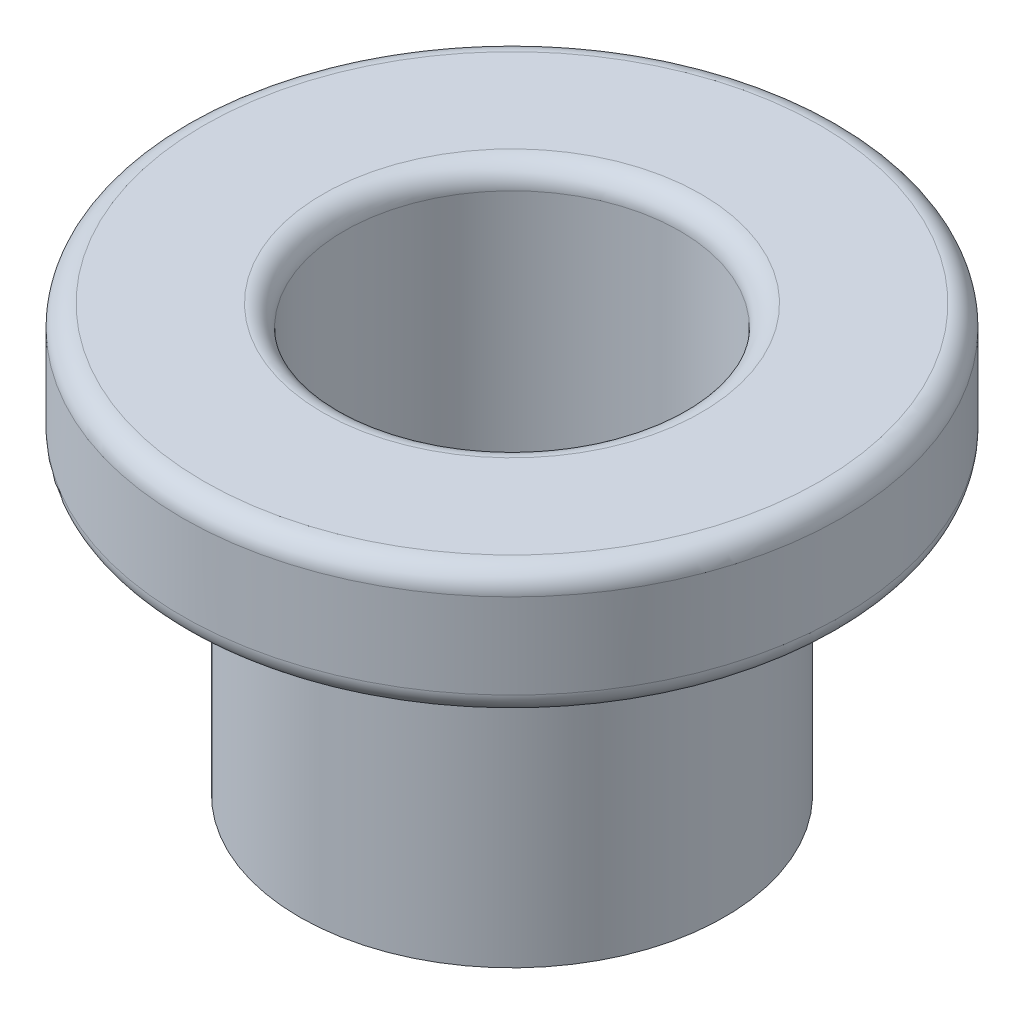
SolidWorks part; units mm, degrees
ref_plane "Front" through (0, 0, 0) normal (0, 0, 1) x (1, 0, 0)
ref_plane "Top" through (0, 0, 0) normal (0, 1, 0) x (1, 0, 0)
ref_plane "Right" through (0, 0, 0) normal (1, 0, 0) x (0, 0, -1)
sketch "Sketch1" plane through (0, 0, 0) normal (0, 0, 1) x (1, 0, 0)
  line L0 (2.0066, 0) -> (2.0066, 5.08)
  line L1 (2.0066, 5.08) -> (3.937, 5.08)
  line L2 (3.937, 5.08) -> (3.937, 3.556)
  line L3 (3.937, 3.556) -> (2.54, 3.556)
  line L4 (2.54, 3.556) -> (2.54, 0)
  line L5 (2.54, 0) -> (2.0066, 0)
  line L6 (0, 0) -> (0, 5.08) construction
  dimension "D1" = 2.54
  dimension "D2" = 2.0066
  dimension "D3" = 3.937
  dimension "D4" = 1.524
  dimension "D5" = 5.08
revolve "Revolve1" add sketch "Sketch1" angle 360 about L6
fillet "Fillet1" radius 0.254 3 edges at (0, 3.556, -3.937) (0, 5.08, -3.937) (0, 5.08, -2.0066)
